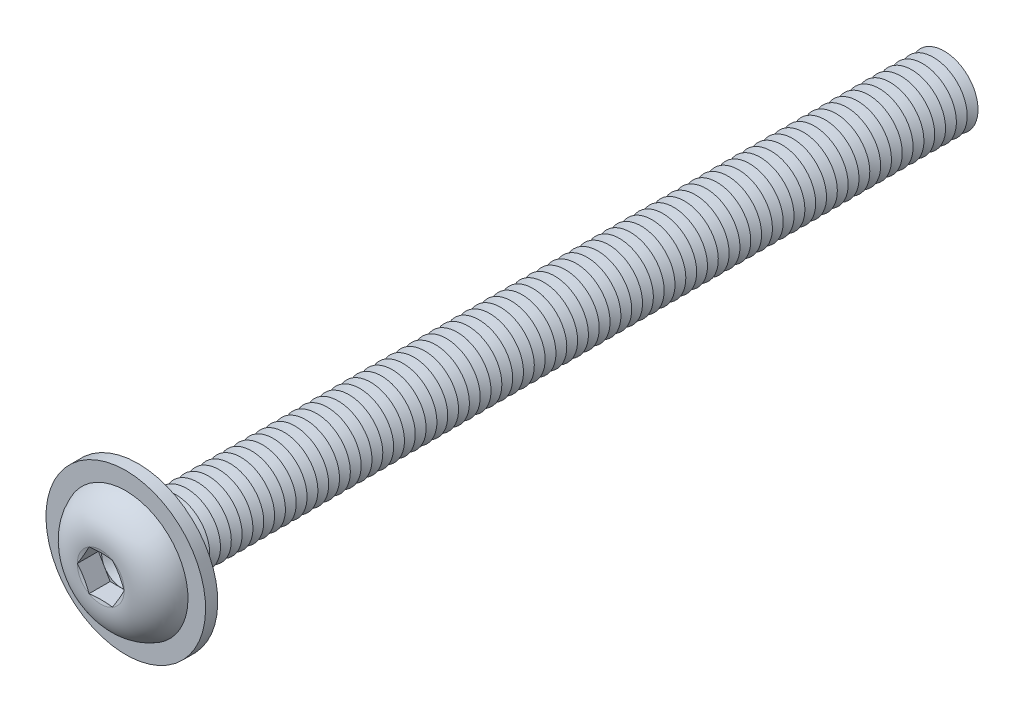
SolidWorks part; units mm, degrees
ref_plane "Front Plane" through (0, 0, 0) normal (0, 0, 1) x (1, 0, 0)
ref_plane "Top Plane" through (0, 0, 0) normal (0, 1, 0) x (1, 0, 0)
ref_plane "Right Plane" through (0, 0, 0) normal (1, 0, 0) x (0, 0, -1)
sketch "Sketch1" plane through (0, 0, 0) normal (1, 0, 0) x (0, 0, -1)
  line L0 (0, 2.5) -> (0, 4.75)
  line L3 (0, 2.5) -> (60, 2.5)
  line L4 (60, 2.5) -> (60, 0)
  line L5 (60, 0) -> (-2.75, 0) construction
  line L6 (-2.75, 0) -> (60, 0)
  line L7 (-2.75, 1.732) -> (-2.75, 0.866) construction
  line L8 (-2.75, 0.866) -> (-2.75, 0)
  line L9 (-2.75, 1.732) -> (-2.5179, 0.866)
  line L10 (-2.5179, 0.866) -> (-2.75, 0.866)
  line L11 (60, 0) -> (22.7481, 0) construction
  line L12 (0, 4.75) -> (-2.75, 4.75) construction
  arc A1 (0, 4.75) -> (-2.75, 1.732) centre (0, 1.9881) ccw
  point P8 (60, 1.25)
  dimension "D1" = 9.5
  dimension "D2" = 5
  dimension "D3" = 2.75
  dimension "D4" = 3.4641
  dimension "D5" = 60
  dimension "D6" = 15
revolve "Revolve1" add sketch "Sketch1" angle 360 about L5
fillet "Fillet1" radius 0.4 1 edges at (0, 2.5, 0)
sketch "Sketch2" plane through (0, 0, 0) normal (1, 0, 0) x (0, 0, -1)
  line L0 (59.6, 2.5) -> (60.4, 2.5)
  line L1 (60, 2.5) -> (0.4, 2.5) construction
  line L2 (60.4, 2.5) -> (60, 1.8072)
  line L3 (60, -2.5) -> (60, 2.5) construction
  line L4 (60, 1.8072) -> (59.6, 2.5)
  dimension "D1" = 0.8
revolve "Cut-Revolve1" cut sketch "Sketch2" angle 360 about axis through (0, 0, -60) along (0, 0, -1)
pattern_linear "LPattern1" count 75 spacing 0.8 along (0, 0, 1) of "Cut-Revolve1"
sketch "Sketch3" plane through (0, 0, 2.75) normal (0, 0, 1) x (1, 0, 0)
  line L7 (0.866, 1.5) -> (-0.866, 1.5)
  line L8 (-0.866, 1.5) -> (-1.7321, 0)
  line L9 (-1.7321, 0) -> (-0.866, -1.5)
  line L10 (-0.866, -1.5) -> (0.866, -1.5)
  line L11 (0.866, -1.5) -> (1.732, 0)
  line L12 (1.732, 0) -> (0.866, 1.5)
  circle A0 centre (0, 0) radius 1.5 construction
  circle A3 centre (0, 0) radius 1.7321 construction
extrude "Cut-Extrude1" cut sketch "Sketch3" against normal blind 1.56
sketch "Sketch4" plane through (0, 0, 1.19) normal (0, 0, 1) x (1, 0, 0)
  line L1 (0.866, 1.5) -> (-0.866, 1.5) construction
  circle A0 centre (0, 0) radius 1.5
extrude "Cut-Extrude2" cut sketch "Sketch4" against normal through all draft 60
sketch "Sketch5" plane through (0, 0, 0) normal (0, 0, -1) x (-1, 0, 0)
  circle A0 centre (0, 0) radius 5.9
  circle A1 centre (0, 0) radius 2.9
  circle A2 centre (0, 0) radius 2.9 construction
  dimension "D1" = 11.8
extrude "Boss-Extrude1" add sketch "Sketch5" against normal blind 0.9
